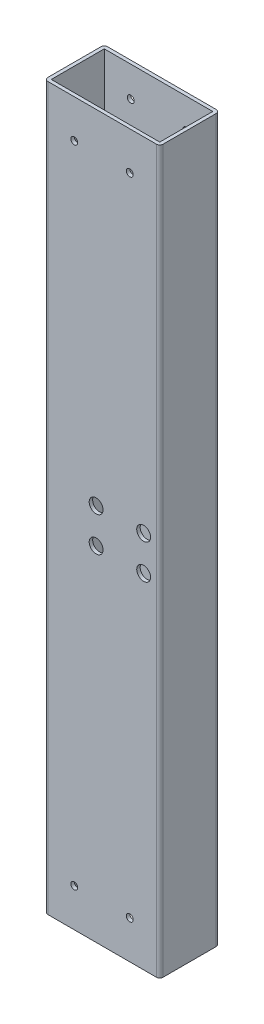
SolidWorks part; units mm, degrees
ref_plane "Front Plane" through (0, 0, 0) normal (0, 0, 1) x (1, 0, 0)
ref_plane "Top Plane" through (0, 0, 0) normal (0, 1, 0) x (1, 0, 0)
ref_plane "Right Plane" through (0, 0, 0) normal (1, 0, 0) x (0, 0, -1)
sketch "Sketch1" plane through (0, 0, 0) normal (0, 1, 0) x (1, 0, 0)
  line L1 (-24.8285, -13.716) -> (24.8285, -13.716)
  line L2 (-26.416, -12.1285) -> (-26.416, 12.1285)
  line L3 (-24.8285, 13.716) -> (24.8285, 13.716)
  line L4 (26.416, -12.1285) -> (26.416, 12.1285)
  line L5 (-26.416, -13.716) -> (26.416, 13.716) construction
  line L6 (-26.416, 13.716) -> (26.416, -13.716) construction
  arc A0 (-24.8285, -13.716) -> (-26.416, -12.1285) centre (-24.8285, -12.1285) cw
  arc A1 (24.8285, -13.716) -> (26.416, -12.1285) centre (24.8285, -12.1285) ccw
  arc A2 (24.8285, 13.716) -> (26.416, 12.1285) centre (24.8285, 12.1285) cw
  arc A3 (-26.416, 12.1285) -> (-24.8285, 13.716) centre (-24.8285, 12.1285) cw
  point P0 (0, 0)
  dimension "D3" = 1.5875
  dimension "D1" = 52.832
  dimension "D2" = 27.432
extrude "Extrude-Thin1" add sketch "Sketch1" along normal mid plane 330.2 thin
sketch "Sketch2" plane through (0, 0, 0) normal (0, 0, 1) x (1, 0, 0)
  line L0 (-12.7, 151.257) -> (12.7, 151.257) construction
  line L1 (-24.8285, 165.1) -> (24.8285, 165.1) construction
  line L2 (-24.8285, -165.1) -> (24.8285, -165.1) construction
  circle A0 centre (-12.7, 151.257) radius 1.5875
  circle A1 centre (12.7, 151.257) radius 1.5875
  circle A2 centre (12.7, -151.257) radius 1.5875
  circle A3 centre (-12.7, -151.257) radius 1.5875
  point P10 (0, 165.1)
  point P11 (0, 151.257)
  dimension "D1" = 2
  dimension "D3" = 3.175
  dimension "D4" = 13.843
  dimension "D5" = 13.843
  dimension "D6" = 25.4
  dimension "D2" = 2
extrude "Cut-Extrude1" cut sketch "Sketch2" against normal through all
sketch "Sketch3" plane through (0, 0, 0) normal (0, 0, 1) x (1, 0, 0)
  line L0 (12.7, -151.257) -> (12.7, -147.6375) construction
  circle A0 centre (12.7, -147.6375) radius 1.5875
  circle A1 centre (-12.7, -147.6375) radius 1.5875
  circle A2 centre (-12.7, 147.6375) radius 1.5875
  circle A3 centre (12.7, 147.6375) radius 1.5875
  circle A4 centre (12.7, -151.257) radius 1.5875 construction
  circle A6 centre (12.7, 151.257) radius 1.5875 construction
  dimension "D1" = 2
  dimension "D3" = 3.6195
  dimension "D4" = 3.6195
  dimension "D2" = 2
extrude "Cut-Extrude2" cut sketch "Sketch3" along normal through all
sketch "Sketch4" plane through (0, 0, -13.716) normal (0, 0, -1) x (-1, 0, 0)
  line L0 (2.7, 7.9375) -> (2.7, -7.9375) construction
  line L1 (-24.8285, 165.1) -> (24.8285, 165.1) construction
  line L2 (-24.8285, 165.1) -> (-24.8285, -165.1) construction
  circle A4 centre (-19.05, 7.9375) radius 3.175
  circle A5 centre (-19.05, -7.9375) radius 3.175
  circle A6 centre (2.7, -7.9375) radius 3.175
  circle A7 centre (2.7, 7.9375) radius 3.175
  dimension "D5" = 6.35
  dimension "D1" = 15.875
  dimension "D2" = 21.75
  dimension "D3" = 157.1625
  dimension "D4" = 5.7785
extrude "Cut-Extrude3" cut sketch "Sketch4" against normal through all
